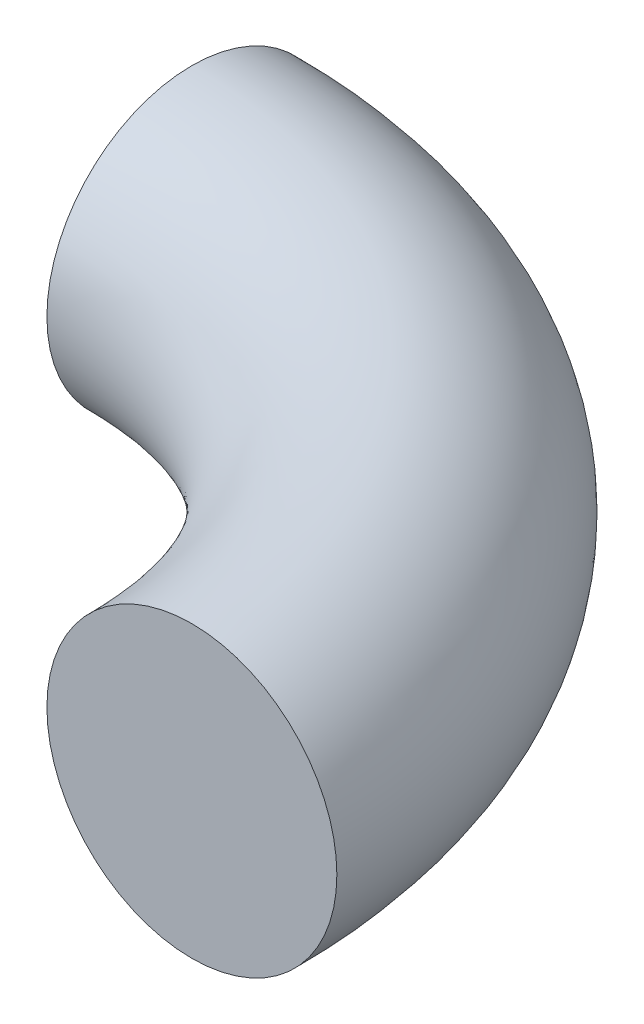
SolidWorks part; units mm, degrees
ref_plane "前视基准面" through (0, 0, 0) normal (0, 0, 1) x (1, 0, 0)
ref_plane "上视基准面" through (0, 0, 0) normal (0, 1, 0) x (1, 0, 0)
ref_plane "右视基准面" through (0, 0, 0) normal (1, 0, 0) x (0, 0, -1)
other "Configuration Table"
sketch "草图6" plane through (0, 0, 0) normal (0, 1, 0) x (1, 0, 0)
  circle A0 centre (0, 0) radius 100
sketch "草图7" plane through (0, 0, 0) normal (0, 0, 1) x (1, 0, 0)
  line L0 (100, 0) -> (-100, 0) construction
  circle A0 centre (100, 0) radius 30
sweep "扫描1" add profiles "草图7" path "草图6"
sketch "草图9" plane through (0, 0, 0) normal (0, 1, 0) x (1, 0, 0)
  line L0 (0, 0) -> (147.9767, 0)
  line L2 (0, 0) -> (0, 155.3755)
  point P3 (0, 0)
  point P4 (0, 0)
extrude "切除-拉伸2" cut sketch "草图9" against normal through all and the other way through all contours L0 L2
